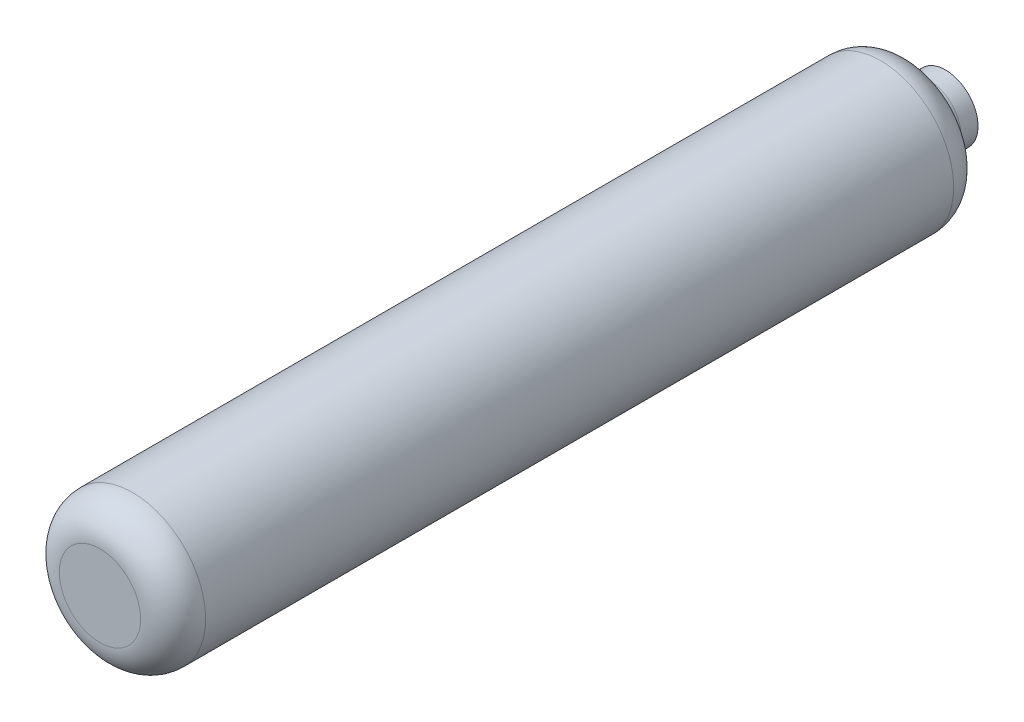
SolidWorks part; units mm, degrees
ref_plane "Front Plane" through (0, 0, 0) normal (0, 0, 1) x (1, 0, 0)
ref_plane "Top Plane" through (0, 0, 0) normal (0, 1, 0) x (1, 0, 0)
ref_plane "Right Plane" through (0, 0, 0) normal (1, 0, 0) x (0, 0, -1)
sketch "Sketch1" plane through (0, 0, 0) normal (0, 0, 1) x (1, 0, 0)
  circle A0 centre (0, 0) radius 225
  dimension "D1" = 450
extrude "Boss-Extrude1" add sketch "Sketch1" along normal blind 2500
fillet "Fillet1" radius 100 2 edges at (225, 0, 2500) (225, 0, 0)
sketch "Sketch2" plane through (0, 0, 0) normal (0, 0, -1) x (-1, 0, 0)
  circle A0 centre (0, 0) radius 100
extrude "Boss-Extrude2" add sketch "Sketch2" along normal blind 100
fillet "Fillet2" radius 50 1 edges at (100, 0, 0)
scale "Scale1" scale about centroid uniform scaling yes scale factor 0.105
